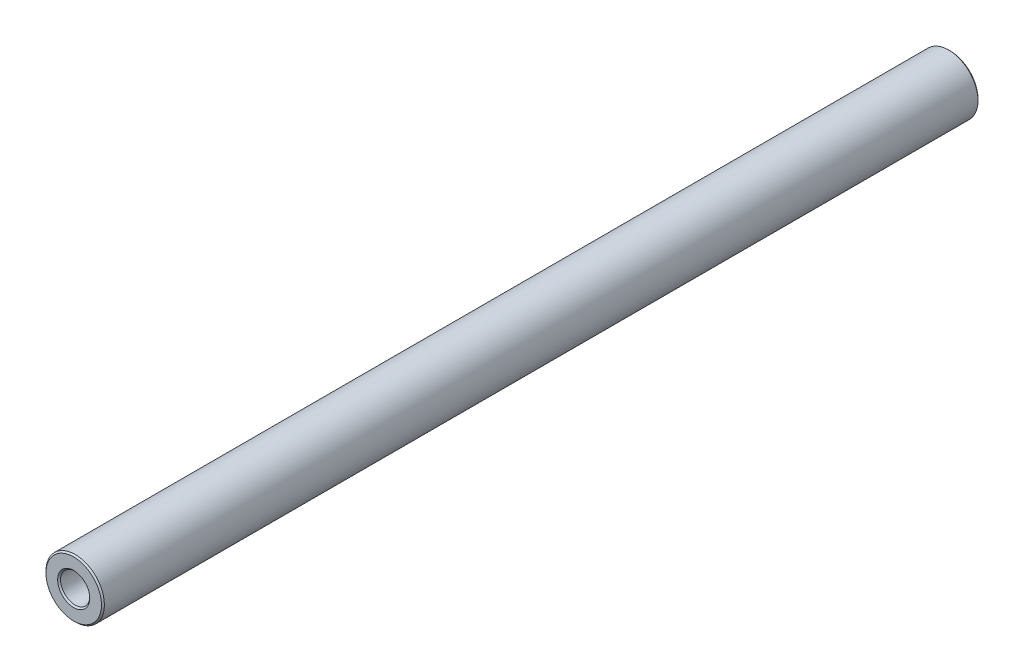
SolidWorks part; units mm, degrees
ref_plane "Front Plane" through (0, 0, 0) normal (0, 0, 1) x (1, 0, 0)
ref_plane "Top Plane" through (0, 0, 0) normal (0, 1, 0) x (1, 0, 0)
ref_plane "Right Plane" through (0, 0, 0) normal (1, 0, 0) x (0, 0, -1)
other "Table"
sketch "Sketch1" plane through (0, 0, 0) normal (0, 0, 1) x (1, 0, 0)
  circle A0 centre (0, 0) radius 5
  circle A1 centre (0, 0) radius 2.5
  dimension "OD" = 10
  dimension "ID" = 5
extrude "Boss-Extrude1" add sketch "Sketch1" along normal mid plane 150
chamfer "Chamfer1" distance 0.25 angle 45 4 edges at (2.5, 0, -75) (2.5, 0, 75) (5, 0, -75) (5, 0, 75)
